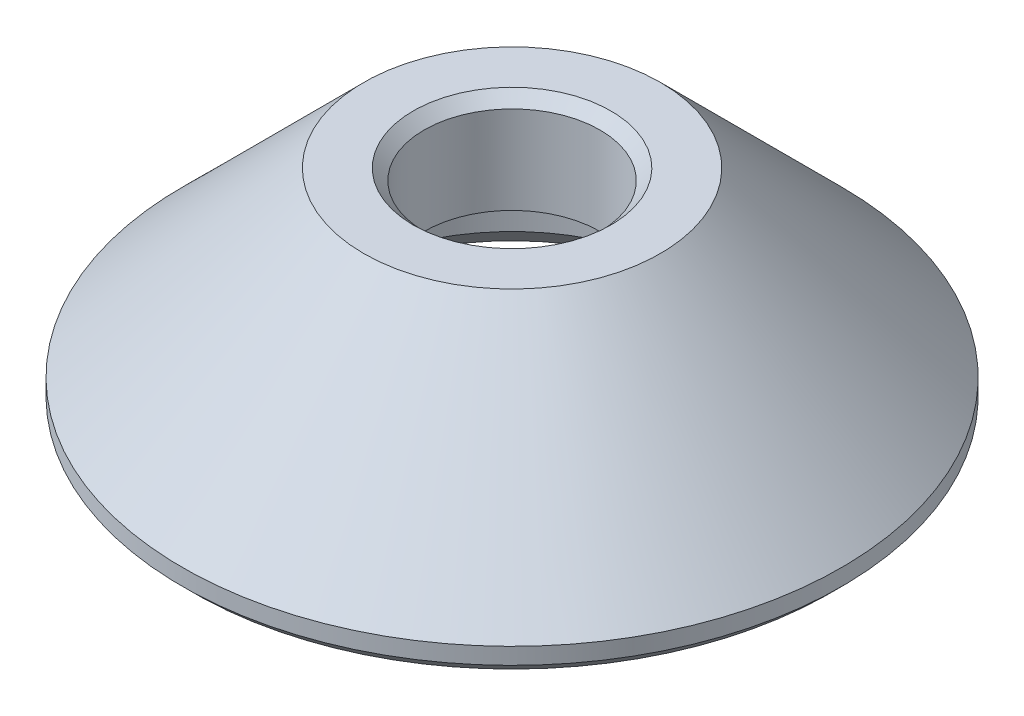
SolidWorks part; units mm, degrees
ref_plane "Front Plane" through (0, 0, 0) normal (0, 0, 1) x (1, 0, 0)
ref_plane "Top Plane" through (0, 0, 0) normal (0, 1, 0) x (1, 0, 0)
ref_plane "Right Plane" through (0, 0, 0) normal (1, 0, 0) x (0, 0, -1)
sketch "Sketch1" plane through (0, 0, 0) normal (0, 0, 1) x (1, 0, 0)
  line L0 (0, 0) -> (0, 1.9458) construction
  line L1 (3.25, -0.2452) -> (6, -0.2452)
  line L2 (1.6, 3.5548) -> (1.6, 1.7548)
  line L3 (1.6, 1.7548) -> (3.25, 1.7548)
  line L4 (6, -0.2452) -> (6, 0.2548)
  line L5 (3.25, 1.7548) -> (3.25, -0.2452)
  line L6 (1.6, 3.5548) -> (2.7, 3.5548)
  line L7 (2.7, 3.5548) -> (6, 0.2548)
  dimension "D1" = 0.5
  dimension "D2" = 2
  dimension "D3" = 45
  dimension "D4" = 3.8
revolve "Revolve1" add sketch "Sketch1" angle 360 about L0
chamfer "Chamfer1" distance 0.5 angle 45 1 edges at (0, -0.2452, -3.25)
chamfer "Chamfer2" distance 0.2 angle 45 2 edges at (0, -0.2452, -6) (0, 3.5548, -1.6)
